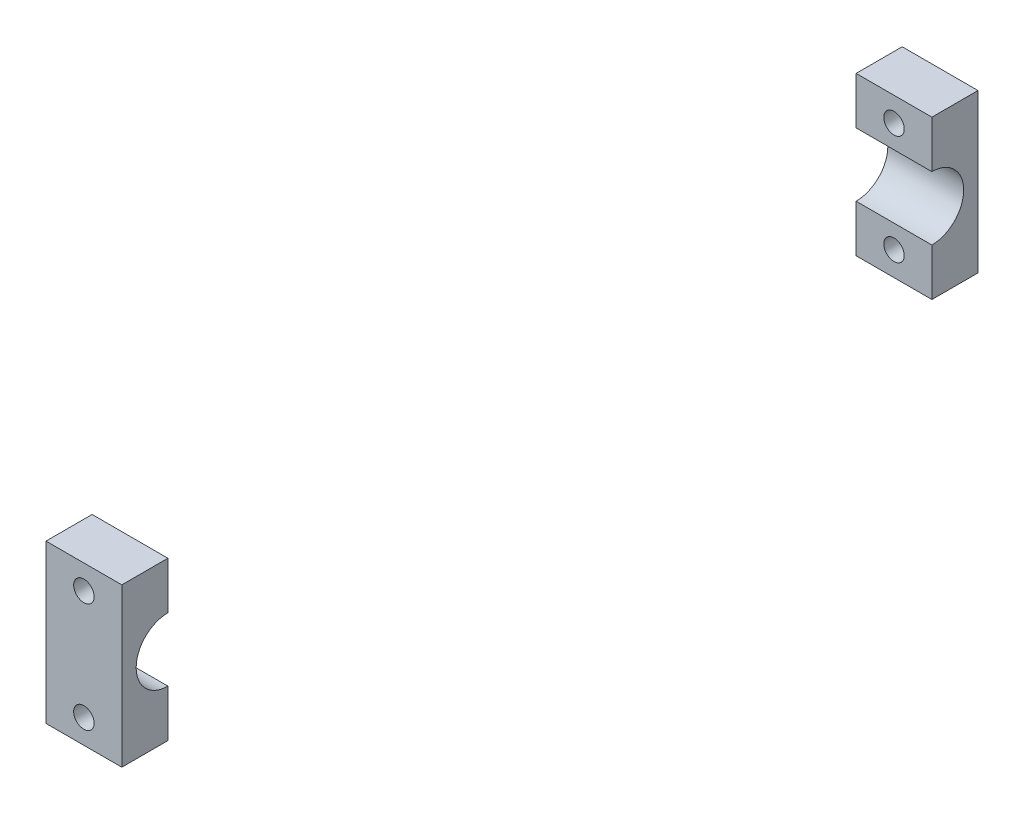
SolidWorks part; units mm, degrees
ref_plane "Front Plane" through (0, 0, 0) normal (0, 0, 1) x (1, 0, 0)
ref_plane "Top Plane" through (0, 0, 0) normal (0, 1, 0) x (1, 0, 0)
ref_plane "Right Plane" through (0, 0, 0) normal (1, 0, 0) x (0, 0, -1)
sketch "Sketch2" plane through (0, 0, 0) normal (1, 0, 0) x (0, 0, -1)
  line L1 (-90, -4.5) -> (90, -4.5)
  line L2 (-90, -4.5) -> (-90, 4.5)
  line L3 (-90, 4.5) -> (90, 4.5)
  line L4 (90, -4.5) -> (90, 4.5)
  line L5 (-90, -4.5) -> (90, 4.5) construction
  line L6 (-90, 4.5) -> (90, -4.5) construction
  point P0 (0, 0)
  dimension "D1" = 9
  dimension "D2" = 180
extrude "Boss-Extrude1" add sketch "Sketch2" along normal blind 14.8
sketch "Sketch3" plane through (14.8, 0, 0) normal (1, 0, 0) x (0, 0, -1)
  line L0 (-90, -4.5) -> (90, -4.5) construction
  line L1 (-74.579, -4.5) -> (74.579, -4.5) construction
  line L7 (90, -4.5) -> (90, 4.5)
  line L8 (90, 4.5) -> (-90, 4.5)
  line L9 (-90, 4.5) -> (-90, -4.5)
  line L10 (-90, -4.5) -> (90, -4.5)
  line L11 (90, -4.5) -> (90, 4.5)
  line L12 (90, 4.5) -> (-90, 4.5)
  line L13 (-90, 4.5) -> (-90, -4.5)
  arc A0 (-68.379, -4.5) -> (-80.779, -4.5) centre (-74.579, -4.5) ccw
  arc A1 (80.779, -4.5) -> (68.379, -4.5) centre (74.579, -4.5) ccw
  point P10 (0, -4.5)
  dimension "D1" = 6.2
  dimension "D2" = 149.158
  dimension "D4" = 0
extrude "Bar Holes" [suppressed] cut sketch "Sketch3" against normal through all
sketch "Sketch6" [suppressed] plane through (0, 4.5, 0) normal (0, 1, 0) x (1, 0, 0)
  line L0 (7.4, 63.879) -> (7.4, -63.879) construction
  line L1 (14.8, 90) -> (0, 90) construction
  line L2 (14.8, -90) -> (0, -90) construction
  line L3 (0, -68.379) -> (14.8, -68.379) construction
  line L4 (0, -80.779) -> (14.8, -80.779) construction
  line L5 (-32.5661, 0) -> (77.6197, 0) construction
  circle A0 centre (7.4, 63.879) radius 2
  circle A1 centre (7.4, -63.879) radius 2
  circle A2 centre (7.4, -85.279) radius 2
  circle A3 centre (7.4, 85.279) radius 2
  circle A4 centre (7.4, -32.5) radius 3.5 construction
  circle A5 centre (7.4, 32.5) radius 3.5 construction
  point P4 (7.4, 0)
  point P8 (7.4, 90)
  point P17 (7.4, -90)
  dimension "D1" = 4
  dimension "D2" = 4
  dimension "D5" = 4
  dimension "D6" = 4
  dimension "D10" = 7
  dimension "D11" = 7
  dimension "D7" = 32.5
  dimension "D3" = 4.5
  dimension "D4" = 4.5
  dimension "D8" = 4.5
  dimension "D9" = 32.5
extrude "Bolt Holes" [suppressed] cut sketch "Sketch6" against normal through all
sketch "Sketch7" plane through (14.8, 0, 0) normal (1, 0, 0) x (0, 0, -1)
  line L0 (-90, -4.5) -> (90, -4.5) construction
  line L1 (-45, -4.5) -> (45, -4.5)
  line L2 (-45, -4.5) -> (-45, 0)
  line L3 (-45, 0) -> (45, 0)
  line L4 (45, -4.5) -> (45, 0)
  point P6 (0, 0)
  dimension "D1" = 90
extrude "Cut-Extrude1" cut sketch "Sketch7" against normal through all
fillet "Fillet1" radius 8 2 edges at (7.4, 0, -45) (7.4, 0, 45)
sketch "Sketch8" plane through (14.8, 0, 0) normal (1, 0, 0) x (0, 0, -1)
  line L0 (83.579, -39.5) -> (83.579, -54.92)
  line L1 (83.579, -4.5) -> (83.579, -39.5)
  line L2 (83.579, -39.5) -> (74.579, -39.5) construction
  line L3 (74.579, -33.3) -> (74.579, -4.5)
  line L4 (45, -4.5) -> (90, -4.5) construction
  line L5 (74.579, -4.5) -> (83.579, -4.5)
  line L6 (83.579, -54.92) -> (74.579, -54.92)
  line L7 (74.579, -54.92) -> (74.579, -45.7)
  line L8 (0, -7.0607) -> (0, -71.6637) construction
  line L9 (-74.579, -54.92) -> (-74.579, -45.7)
  line L10 (-83.579, -54.92) -> (-74.579, -54.92)
  line L11 (-83.579, -39.5) -> (-83.579, -54.92)
  line L12 (-83.579, -4.5) -> (-83.579, -39.5)
  line L13 (-74.579, -4.5) -> (-83.579, -4.5)
  line L14 (-74.579, -33.3) -> (-74.579, -4.5)
  arc A0 (74.579, -45.7) -> (74.579, -33.3) centre (74.579, -39.5) ccw
  arc A1 (-74.579, -45.7) -> (-74.579, -33.3) centre (-74.579, -39.5) cw
  dimension "D1" = 15.42
  dimension "D2" = 35
  dimension "D3" = 9
extrude "Boss-Extrude2" add sketch "Sketch8" against normal blind 14.8
sketch "Sketch11" plane through (0, 0, 74.579) normal (0, 0, -1) x (-1, 0, 0)
  line L0 (-7.4, -33.3) -> (-7.4, -28.8) construction
  line L1 (0, -33.3) -> (-14.8, -33.3) construction
  line L2 (-7.4, -33.3) -> (-7.4, -45.7) construction
  line L3 (0, -45.7) -> (-14.8, -45.7) construction
  line L4 (-7.4, -39.5) -> (0, -39.5) construction
  circle A1 centre (-7.4, -28.8) radius 2
  circle A2 centre (-7.4, -50.2) radius 2
  dimension "D1" = 4.5
extrude "Cut-Extrude2" cut sketch "Sketch11" along normal through all both and the other way through all
sketch "Sketch12" plane through (0, 0, 0) normal (-1, 0, 0) x (0, 0, 1)
  line L4 (96.9862, 8.7415) -> (-95.1532, 8.7415)
  line L5 (96.9862, 8.7415) -> (96.9862, -4.5)
  line L9 (-95.1532, 8.7415) -> (-95.1532, -16.0389)
  line L11 (96.9862, -16.0389) -> (96.9862, -4.5)
  line L12 (74.579, -33.3) -> (74.579, -24.08) construction
  line L13 (74.579, -33.3) -> (74.579, -4.5) construction
  line L15 (74.579, -24.08) -> (96.9862, -24.08)
  line L16 (96.9862, -24.08) -> (96.9862, -16.0389)
  line L17 (74.579, -24.08) -> (-95.1532, -24.08)
  line L18 (-95.1532, -24.08) -> (-95.1532, -16.0389)
  dimension "D1" = 9.22
extrude "Cut-Extrude3" cut sketch "Sketch12" against normal through all both
